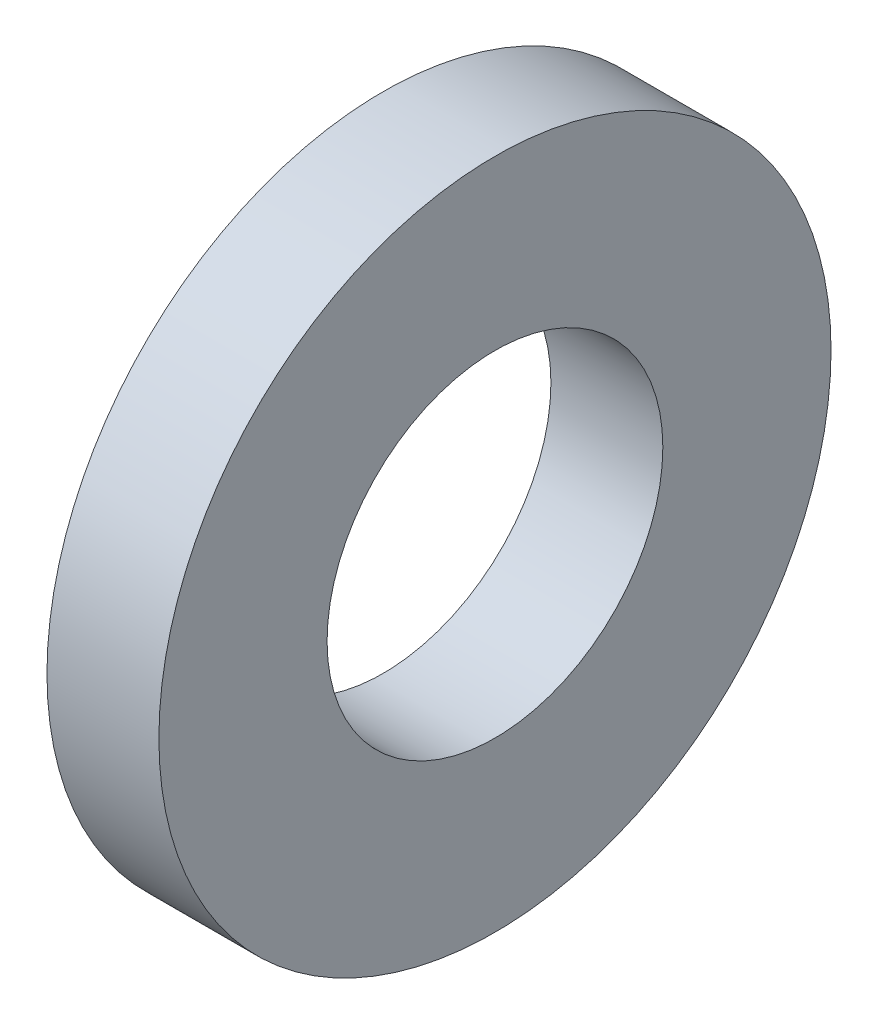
SolidWorks part; units mm, degrees
ref_plane "Plane1" through (0, 0, 0) normal (0, 0, 1) x (1, 0, 0)
ref_plane "Plane2" through (0, 0, 0) normal (0, 1, 0) x (1, 0, 0)
ref_plane "Plane3" through (0, 0, 0) normal (1, 0, 0) x (0, 0, -1)
sketch "Sketch1" plane through (0, 0, 0) normal (0, 0, 1) x (1, 0, 0)
  line L0 (0, 0) -> (-16.9314, 0) construction
  line L2 (0, 6.7437) -> (-4.4958, 6.7437)
  line L3 (0, 6.7437) -> (0, 13.5001)
  line L4 (0, 13.5001) -> (-4.4958, 13.5001)
  line L5 (-4.4958, 6.7437) -> (-4.4958, 13.5001)
  dimension "Outside_dia" = 27.0002
  dimension "Thickness" = 4.4958
  dimension "Inside_dia" = 13.4874
revolve "Revolve1" add sketch "Sketch1" angle 360 about L0
